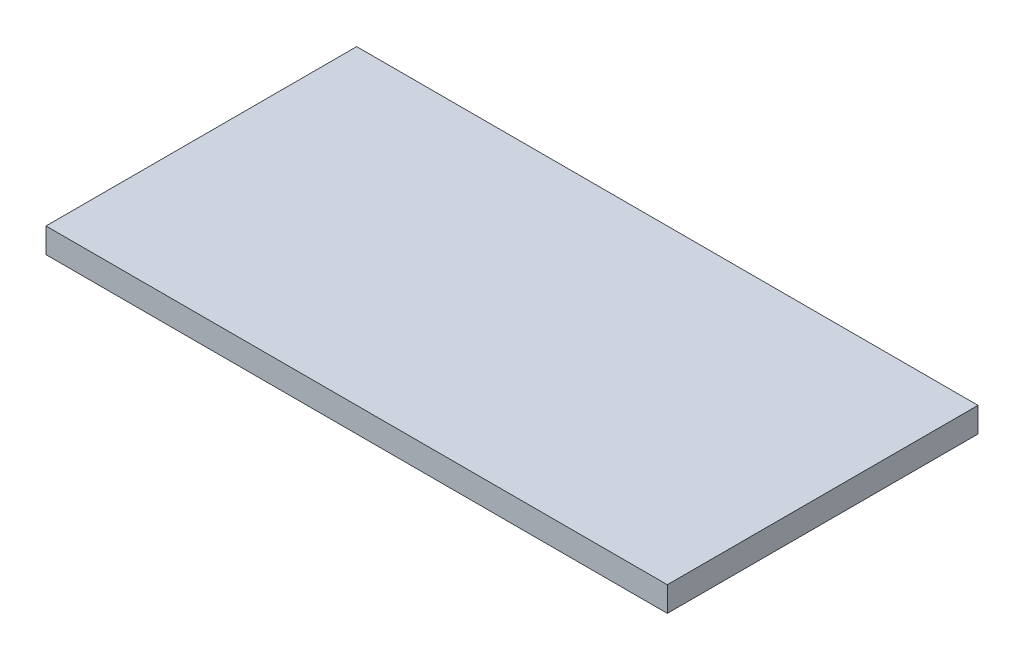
SolidWorks part; units mm, degrees
ref_plane "Front Plane" through (0, 0, 0) normal (0, 0, 1) x (1, 0, 0)
ref_plane "Top Plane" through (0, 0, 0) normal (0, 1, 0) x (1, 0, 0)
ref_plane "Right Plane" through (0, 0, 0) normal (1, 0, 0) x (0, 0, -1)
sketch "Sketch1" plane through (0, 0, 0) normal (0, 1, 0) x (1, 0, 0)
  line L1 (-50, -25) -> (50, -25)
  line L2 (-50, -25) -> (-50, 25)
  line L3 (-50, 25) -> (50, 25)
  line L4 (50, -25) -> (50, 25)
  line L5 (-50, -25) -> (50, 25) construction
  line L6 (-50, 25) -> (50, -25) construction
  point P0 (0, 0)
  dimension "Length" = 100
  dimension "Width" = 50
sheet metal parameters "Sheet-Metal1" thickness 4 parameters "D1"=4
base flange "Base-Flange1" sketch "Sketch1" thickness 4 reverse thickness direction yes parameters "D1"=4
flat pattern "Flat-Pattern1"
sketch "Bend-Lines1" plane through (0, 0, 0) normal (0, 1, 0) x (-1, 0, 0)
equation "\"D1@Sheet-Metal1\" = \"Thickness@Sheet-Metal1\""
